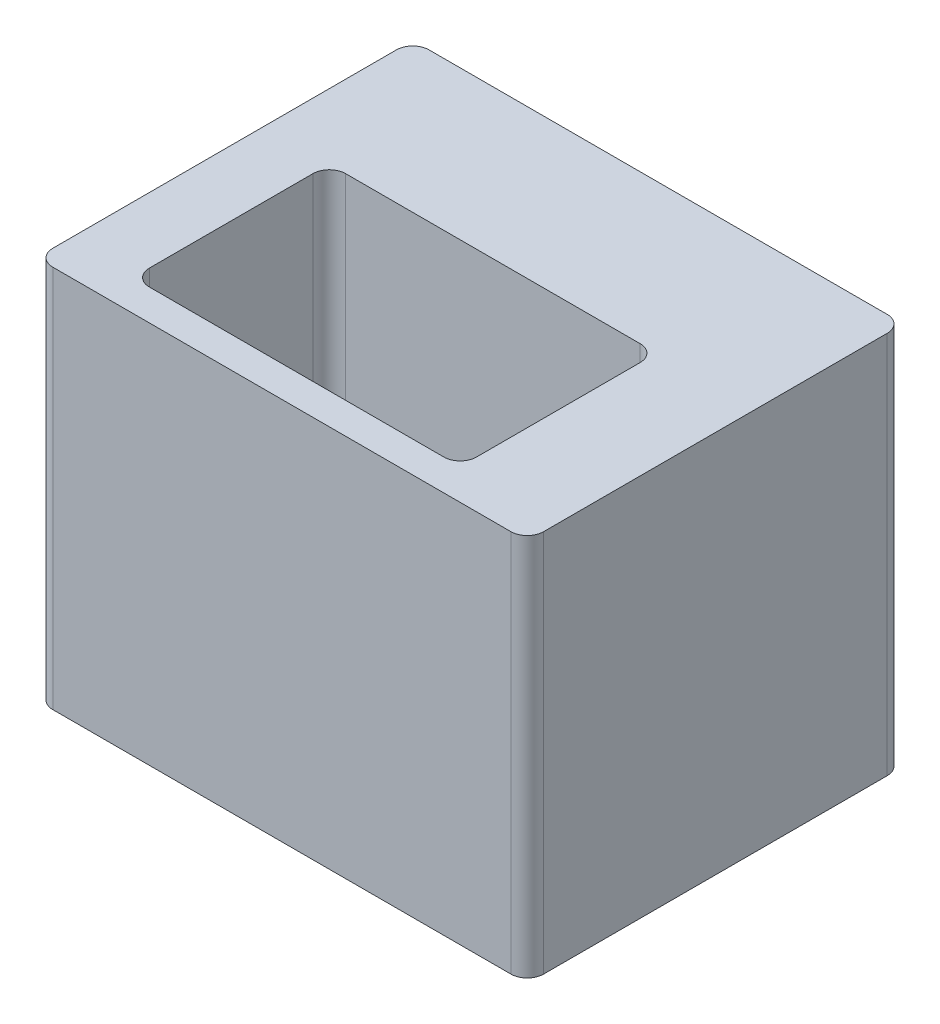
SolidWorks part; units mm, degrees
ref_plane "Front Plane" through (0, 0, 0) normal (0, 0, 1) x (1, 0, 0)
ref_plane "Top Plane" through (0, 0, 0) normal (0, 1, 0) x (1, 0, 0)
ref_plane "Right Plane" through (0, 0, 0) normal (1, 0, 0) x (0, 0, -1)
sketch "Sketch3" plane through (0, 0, 0) normal (0, 1, 0) x (1, 0, 0)
  line L0 (-19.05, 14.605) -> (19.05, -14.605) construction
  line L1 (-19.05, 14.605) -> (19.05, 14.605)
  line L2 (-19.05, 14.605) -> (-19.05, -14.605)
  line L3 (-19.05, -14.605) -> (19.05, -14.605)
  line L4 (19.05, 14.605) -> (19.05, -14.605)
  dimension "D1" = 29.21
  dimension "D2" = 38.1
extrude "Boss-Extrude2" add sketch "Sketch3" along normal blind 29.7434
sketch "Sketch4" plane through (0, 29.7434, 0) normal (0, 1, 0) x (1, 0, 0)
  line L0 (-19.05, -14.605) -> (19.05, -14.605) construction
  line L1 (-13.97, 3.048) -> (11.43, 3.048)
  line L2 (-13.97, 3.048) -> (-13.97, -12.192)
  line L3 (-13.97, -12.192) -> (11.43, -12.192)
  line L4 (11.43, 3.048) -> (11.43, -12.192)
  line L5 (19.05, -14.605) -> (19.05, 14.605) construction
  dimension "D1" = 15.24
  dimension "D2" = 25.4
  dimension "D3" = 2.413
  dimension "D4" = 7.62
extrude "Cut-Extrude1" cut sketch "Sketch4" against normal blind 16.2052
fillet "Fillet1" radius 1.27 8 edges at (-19.05, 14.8717, -14.605) (19.05, 14.8717, -14.605) (19.05, 14.8717, 14.605) (-19.05, 14.8717, 14.605) (11.43, 21.6408, 12.192) (-13.97, 21.6408, 12.192) (11.43, 21.6408, -3.048) (-13.97, 21.6408, -3.048)
